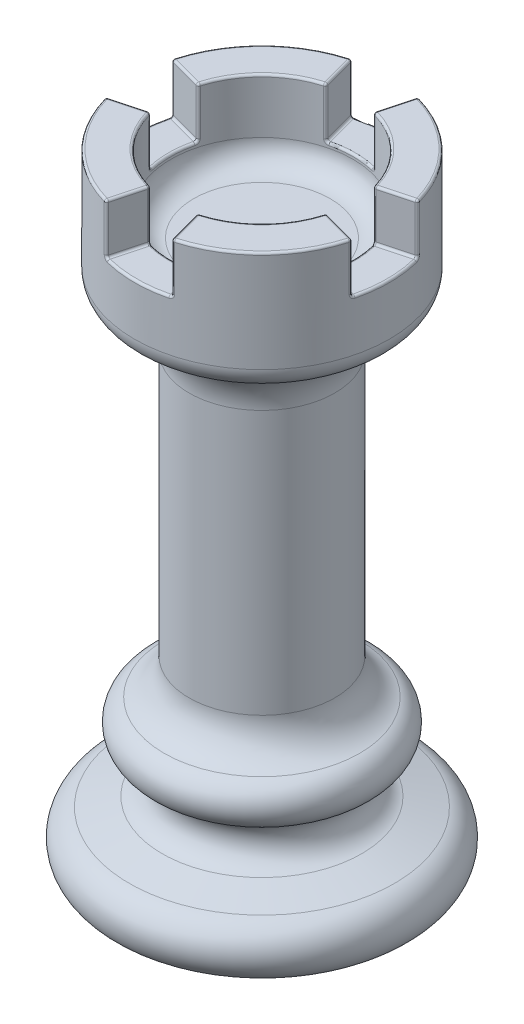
SolidWorks part; units mm, degrees
ref_plane "Front" through (0, 0, 0) normal (0, 0, 1) x (1, 0, 0)
ref_plane "Top" through (0, 0, 0) normal (0, 1, 0) x (1, 0, 0)
ref_plane "Right" through (0, 0, 0) normal (1, 0, 0) x (0, 0, -1)
sketch "Sketch1" plane through (0, 0, 0) normal (0, 0, 1) x (1, 0, 0)
  line L0 (0, 0) -> (0, 72.0534) construction
  line L1 (0, 0) -> (13.97, 0)
  line L2 (14.8003, 5.9807) -> (11.1344, 7.0186)
  line L3 (8.128, 20.575) -> (8.128, 50.039)
  line L4 (14.224, 58.293) -> (14.224, 69.596)
  line L5 (14.224, 69.596) -> (10.16, 69.596)
  line L6 (0, 60.96) -> (0, 0)
  line L7 (10.16, 69.596) -> (10.16, 63.5)
  line L8 (7.62, 60.96) -> (0, 60.96)
  arc A0 (13.97, 0) -> (14.8003, 5.9807) centre (13.97, 3.048) ccw
  arc A1 (11.1344, 7.0186) -> (10.941, 11.8433) centre (11.8263, 9.4625) cw
  arc A2 (10.941, 11.8433) -> (10.914, 16.6146) centre (10.0557, 14.224) ccw
  arc A3 (10.914, 16.6146) -> (8.128, 20.575) centre (12.3359, 20.575) cw
  arc A4 (8.128, 50.039) -> (12.4311, 55.8653) centre (14.224, 50.039) cw
  arc A5 (7.62, 60.96) -> (10.16, 63.5) centre (7.62, 63.5) ccw
  arc A6 (14.224, 58.293) -> (12.4311, 55.8653) centre (11.684, 58.293) cw
  dimension "D2" = 3.048
  dimension "D4" = 2.54
  dimension "D5" = 2.54
  dimension "D7" = 8.128
  dimension "D8" = 4.064
  dimension "D9" = 8.636
  dimension "D11" = 6.096
  dimension "D12" = 14.224
  dimension "D13" = 29.464
  dimension "D14" = 13.97
  dimension "D15" = 11.8263
  dimension "D16" = 4.2079
  dimension "D3" = 3.81
  dimension "D6" = 60.96
  dimension "D10" = 14.224
revolve "Base-Revolve" add sketch "Sketch1" angle 360 about L0
sketch "Sketch2" plane through (0, 69.596, 0) normal (0, 1, 0) x (-1, 0, 0)
  line L0 (-9.8138, -2.6296) -> (-13.7393, -3.6814)
  line L1 (0, 0) -> (-18.558, 0) construction
  line L2 (-9.8138, 2.6296) -> (-13.7393, 3.6814)
  circle A0 centre (0, 0) radius 10.16 construction
  circle A1 centre (0, 0) radius 14.224
  arc A2 (-13.7393, 3.6814) -> (-13.7393, -3.6814) centre (0, 0) ccw
  arc A3 (-9.8138, 2.6296) -> (-9.8138, -2.6296) centre (0, 0) ccw
  dimension "D2" = 15
  dimension "D1" = 0
extrude "Cut-Extrude1" cut sketch "Sketch2" against normal blind 5.588
pattern_circular "CirPattern1" count 4 over 360 about axis through (0, 0, 0) along (0, 1, 0) of "Cut-Extrude1"
fillet "Fillet1" radius 0.254 48 edges at (-3.6814, 66.802, -13.7393) (3.6814, 66.802, -13.7393) (13.7393, 66.802, -3.6814) (13.7393, 66.802, 3.6814) (3.6814, 66.802, 13.7393) (-3.6814, 66.802, 13.7393) (-13.7393, 66.802, 3.6814) (-13.7393, 66.802, -3.6814) (-3.1555, 64.008, -11.7766) (0, 64.008, -14.224) (3.1555, 64.008, -11.7766) (10.0579, 69.596, -10.0579) (11.7766, 69.596, -3.1555) (7.1842, 69.596, -7.1842) (3.1555, 69.596, -11.7766) (11.7766, 64.008, -3.1555) (14.224, 64.008, 0) (11.7766, 64.008, 3.1555) (7.1842, 69.596, 7.1842) (11.7766, 69.596, 3.1555) (10.0579, 69.596, 10.0579) (3.1555, 69.596, 11.7766) (3.1555, 64.008, 11.7766) (0, 64.008, 14.224) (-3.1555, 64.008, 11.7766) (-10.0579, 69.596, 10.0579) (-11.7766, 69.596, 3.1555) (-7.1842, 69.596, 7.1842) (-3.1555, 69.596, 11.7766) (-11.7766, 64.008, 3.1555) (-14.224, 64.008, 0) (-11.7766, 64.008, -3.1555) (-10.0579, 69.596, -10.0579) (-3.1555, 69.596, -11.7766) (-7.1842, 69.596, -7.1842) (-11.7766, 69.596, -3.1555) (-2.6296, 66.802, -9.8138) (2.6296, 66.802, -9.8138) (9.8138, 66.802, -2.6296) (9.8138, 66.802, 2.6296) (2.6296, 66.802, 9.8138) (-2.6296, 66.802, 9.8138) (-9.8138, 66.802, 2.6296) (-9.8138, 66.802, -2.6296) (0, 64.008, -10.16) (10.16, 64.008, 0) (0, 64.008, 10.16) (-10.16, 64.008, 0)
